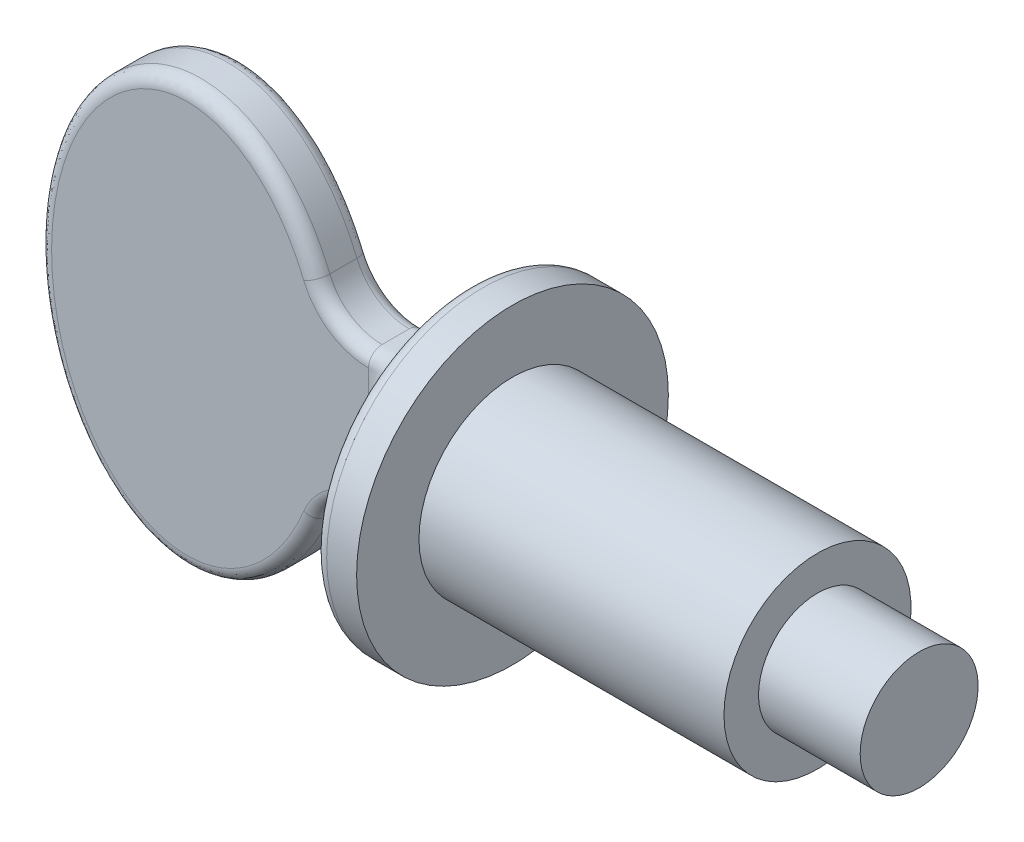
SolidWorks part; units mm, degrees
ref_plane "Front Plane" through (0, 0, 0) normal (0, 0, 1) x (1, 0, 0)
ref_plane "Top Plane" through (0, 0, 0) normal (0, 1, 0) x (1, 0, 0)
ref_plane "Right Plane" through (0, 0, 0) normal (1, 0, 0) x (0, 0, -1)
sketch "layout" plane through (0, 0, 0) normal (0, 0, 1) x (1, 0, 0)
  line L0 (0, 0) -> (13.208, 0) construction
  line L1 (5.588, 2.921) -> (5.588, -2.921)
  line L2 (3.3976, 1.3123) -> (4.8921, 1.3123) construction
  line L3 (5.588, 2.921) -> (4.7897, 2.921)
  line L4 (4.7897, 2.921) -> (4.7897, 3.2655) construction
  line L5 (4.2865, 1.706) -> (4.2865, 0)
  line L6 (4.2865, 1.706) -> (3.3355, 0.7551) construction
  line L7 (13.208, 1.7526) -> (13.208, 0)
  line L8 (3.3976, 1.3123) -> (3.3976, -1.3123)
  line L9 (13.208, 1.7526) -> (5.588, 1.7526)
  arc A0 (3.3976, 1.3123) -> (2.4197, 1.9685) centre (3.3976, 2.3692) cw
  arc A1 (4.7897, 2.921) -> (4.2865, 1.706) centre (3.0715, 2.921) cw
  arc A2 (3.3976, -1.3123) -> (2.4197, -1.9685) centre (3.3976, -2.3692) ccw
  ellipse E0 centre (0, 0) end of major axis (0, 3.937) minor radius 2.794 (2.4197, 1.9685) -> (2.4197, -1.9685) ccw
  dimension "Head Width" = 7.874
  dimension "Shoulder Dia" = 5.842
  dimension "Head Height" = 8.382
  dimension "D4" = 5.588
  dimension "D5" = 2.6247
  dimension "D6" = 3.937
  dimension "D7" = 3.4121
  dimension "D8" = 0.7983
  dimension "D9" = 45
  dimension "Length" = 7.62
  dimension "Base Screw Dia" = 3.5052
sketch "Sketch3" plane through (0, 0, 0) normal (0, 0, 1) x (1, 0, 0)
  line L0 (3.3976, 1.3123) -> (3.3976, -1.3123) construction
  line L1 (3.3976, 1.3123) -> (3.3976, -1.3123)
  arc A0 (3.3976, -1.3123) -> (2.4197, -1.9685) centre (3.3976, -2.3692) ccw construction
  arc A1 (2.4197, 1.9685) -> (3.3976, 1.3123) centre (3.3976, 2.3692) ccw construction
  arc A2 (3.3976, -1.3123) -> (2.4197, -1.9685) centre (3.3976, -2.3692) ccw
  arc A3 (2.4197, 1.9685) -> (3.3976, 1.3123) centre (3.3976, 2.3692) ccw
  ellipse E0 centre (0, 0) end of major axis (0, 3.937) minor radius 2.794 (2.4197, 1.9685) -> (2.4197, -1.9685) ccw construction
  ellipse E1 centre (0, 0) end of major axis (0, 3.937) minor radius 2.794 (2.4197, 1.9685) -> (2.4197, -1.9685) ccw
extrude "Extrude1" add sketch "Sketch3" along normal mid plane 1.016
fillet "Fillet1" radius 0.254 6 edges at (2.8088, 1.4916, -0.508) (2.8088, -1.4916, -0.508) (2.8088, 1.4916, 0.508) (2.8088, -1.4916, 0.508) (-2.794, 0, -0.508) (-2.794, 0, 0.508)
sketch "Sketch4" plane through (0, 0, 0) normal (0, 0, 1) x (1, 0, 0)
  line L0 (13.208, 1.7526) -> (13.208, 0) construction
  line L1 (13.208, 1.7526) -> (5.588, 1.7526) construction
  line L2 (5.588, 2.921) -> (5.588, -2.921) construction
  line L3 (5.588, 2.921) -> (4.7897, 2.921) construction
  line L4 (4.2865, 1.706) -> (4.2865, 0) construction
  line L5 (13.208, 1.1049) -> (13.208, 0)
  line L6 (11.303, 1.7526) -> (5.588, 1.7526)
  line L7 (5.588, 2.921) -> (5.588, 1.7526)
  line L8 (5.588, 2.921) -> (4.7897, 2.921)
  line L9 (4.2865, 1.706) -> (4.2865, 0)
  line L10 (0, 0) -> (16.8942, 0) construction
  line L11 (13.208, 0) -> (4.2865, 0)
  line L12 (13.208, 1.1049) -> (11.303, 1.1049)
  line L13 (11.303, 1.1049) -> (11.303, 1.7526)
  arc A0 (4.2865, 1.706) -> (4.7897, 2.921) centre (3.0715, 2.921) ccw construction
  arc A1 (4.2865, 1.706) -> (4.7897, 2.921) centre (3.0715, 2.921) ccw
  dimension "P" = 2.2098
  dimension "Q" = 1.905
revolve "Revolve1" add sketch "Sketch4" angle 360 about L10
loft "Loft1" add
fillet "Fillet2" radius 0.254 1 edges at (4.7897, 0, 2.921)
sketch "Sketch5" plane through (0, 0, 0) normal (0, 1, 0) x (1, 0, 0)
  line L0 (10.7575, 2.2981) -> (11.303, 2.2981)
  line L1 (11.303, 2.2981) -> (11.303, 1.7526)
  line L2 (11.303, 1.7526) -> (11.0302, 1.2802)
  line L3 (11.0302, 1.2802) -> (10.7575, 1.7526)
  line L5 (10.7575, 1.7526) -> (10.7575, 2.2981)
  line L6 (11.303, -1.7526) -> (11.303, 1.7526) construction
  line L7 (-3.6147, 0) -> (14.1406, 0) construction
  line L8 (11.303, 1.7526) -> (5.588, 1.7526) construction
  dimension "D1" = 0.4724
revolve "Cut-Revolve10" [suppressed] cut sketch "Sketch5" angle 360 about L7
pattern_linear "LPattern10" [suppressed] count 7 along (1, 0, 0)
equation "\"D4@layout\" = \"Head Height@layout\" / 3 * 2"
equation "\"D5@layout\" = \"Head Width@layout\" / 3"
equation "\"D6@layout\" = \"Head Width@layout\" / 2"
equation "\"D7@layout\" = \"D5@layout\" * 1.3"
equation "\"D8@layout\" = \"D4@layout\"  / 7"
equation "\"D1@Fillet1\" = \"Head Thickness@Extrude1\" / 4"
equation "\"D1@Fillet2\" = \"D1@Fillet1\""
equation "\"D1@Sketch5\" = ( \"Base Screw Dia@layout\"- \"Minor Dia@Cosmetic Thread1\" )  / 2"
equation "\"D1@LPattern10\" = int((\"Length@layout\"-\"Q@Sketch4\")/\"Advance@LPattern10\")"
